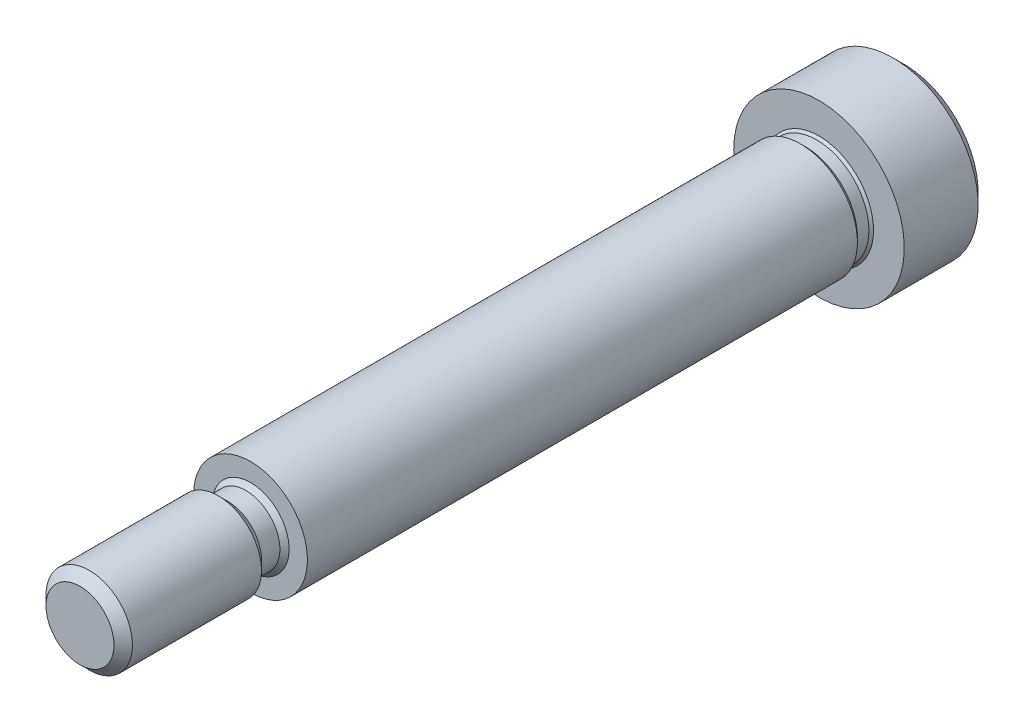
SolidWorks part; units mm, degrees
ref_plane "Front" through (0, 0, 0) normal (0, 0, 1) x (1, 0, 0)
ref_plane "Top" through (0, 0, 0) normal (0, 1, 0) x (1, 0, 0)
ref_plane "Right" through (0, 0, 0) normal (1, 0, 0) x (0, 0, -1)
sketch "Logo3_Revol_Axis" plane through (0, 0, 0) normal (0, 1, 0) x (1, 0, 0)
  line L0 (0, -25.3777) -> (0, 25.3777) construction
sketch "Logo3_bib1" plane through (0, 0, 0) normal (0, -1, 0) x (-1, 0, 0)
  line L0 (0, 62.3527) -> (0, -65.5595) construction
  line L1 (3.175, 0) -> (2.1558, 0)
  line L2 (3.175, 0) -> (3.175, 30.7213)
  line L3 (3.175, 30.7213) -> (2.9178, 30.9785)
  line L4 (4.7625, 35.8775) -> (4.1275, 36.5125)
  line L5 (3.0464, 31.75) -> (4.7625, 31.75)
  line L6 (4.7625, 31.75) -> (4.7625, 35.8775)
  line L7 (4.1275, 36.5125) -> (0, 36.5125)
  line L8 (2.9178, 30.9785) -> (2.9178, 31.6214)
  line L9 (2.413, -1.8002) -> (2.413, -9.0107)
  line L11 (2.413, -9.0107) -> (1.8987, -9.525)
  line L12 (1.8987, -9.525) -> (0, -9.525)
  line L13 (0, -9.525) -> (0, 36.5125)
  line L14 (1.8987, -0.2572) -> (1.8987, -1.2859)
  line L15 (1.8987, -1.2859) -> (2.413, -1.8002)
  line L16 (2.9178, 31.6214) -> (3.0464, 31.75)
  line L17 (1.8987, -0.2572) -> (2.1558, 0)
  point P18 (4.7625, 36.5125)
revolve "Revolve1" add sketch "Logo3_bib1" angle 360 about L0
sketch "Logo3_bib2" plane through (0, 0, -36.5125) normal (0, 0, -1) x (1, 0, 0)
  line L1 (1.8331, 0) -> (0.9165, 1.5875)
  line L2 (0.9165, 1.5875) -> (-0.9165, 1.5875)
  line L3 (-0.9165, 1.5875) -> (-1.8331, 0)
  line L4 (-1.8331, 0) -> (-0.9165, -1.5875)
  line L5 (-0.9165, -1.5875) -> (0.9165, -1.5875)
  line L6 (0.9165, -1.5875) -> (1.8331, 0)
  circle A0 centre (0, 0) radius 1.5875 construction
  dimension "Logo3_c1" = 3.175
extrude "Cut-Extrude1" cut sketch "Logo3_bib2" against normal blind 3.175
equation "\"D2@Cosmetic Thread1\" = \"Logo3_dm-pas@Logo3_bib1\""
